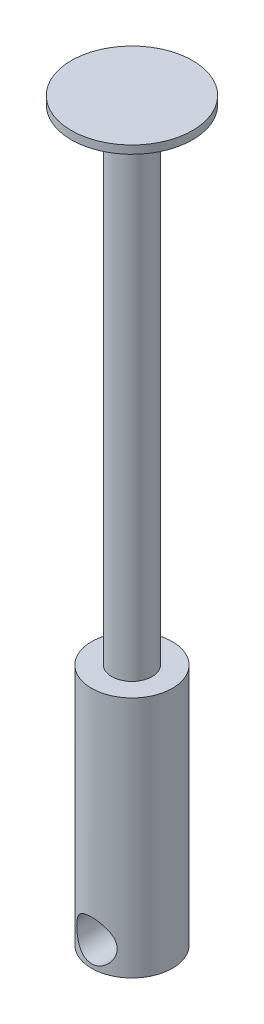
SolidWorks part; units mm, degrees
ref_plane "Front Plane" through (0, 0, 0) normal (0, 0, 1) x (1, 0, 0)
ref_plane "Top Plane" through (0, 0, 0) normal (0, 1, 0) x (1, 0, 0)
ref_plane "Right Plane" through (0, 0, 0) normal (1, 0, 0) x (0, 0, -1)
sketch "Sketch1" plane through (0, 0, 0) normal (0, 1, 0) x (1, 0, 0)
  circle A0 centre (0, 0) radius 5
  dimension "D1" = 10
extrude "Boss-Extrude1" add sketch "Sketch1" along normal blind 30
sketch "Sketch2" plane through (0, 30, 0) normal (0, 1, 0) x (1, 0, 0)
  circle A3 centre (0, 0) radius 2.5
  dimension "D1" = 5
extrude "Boss-Extrude2" add sketch "Sketch2" along normal blind 60
sketch "Sketch3" plane through (0, 90, 0) normal (0, 1, 0) x (1, 0, 0)
  circle A2 centre (0, 0) radius 7.5
  circle A3 centre (0, 0) radius 7.5
  dimension "D1" = 5
extrude "Boss-Extrude3" add sketch "Sketch3" along normal blind 1
sketch "Sketch4" plane through (0, 0, 0) normal (0, 0, 1) x (1, 0, 0)
  circle A0 centre (0, 3) radius 2.5
  dimension "D1" = 5
  dimension "D2" = 3
extrude "Cut-Extrude1" cut sketch "Sketch4" against normal through all both and the other way through all
